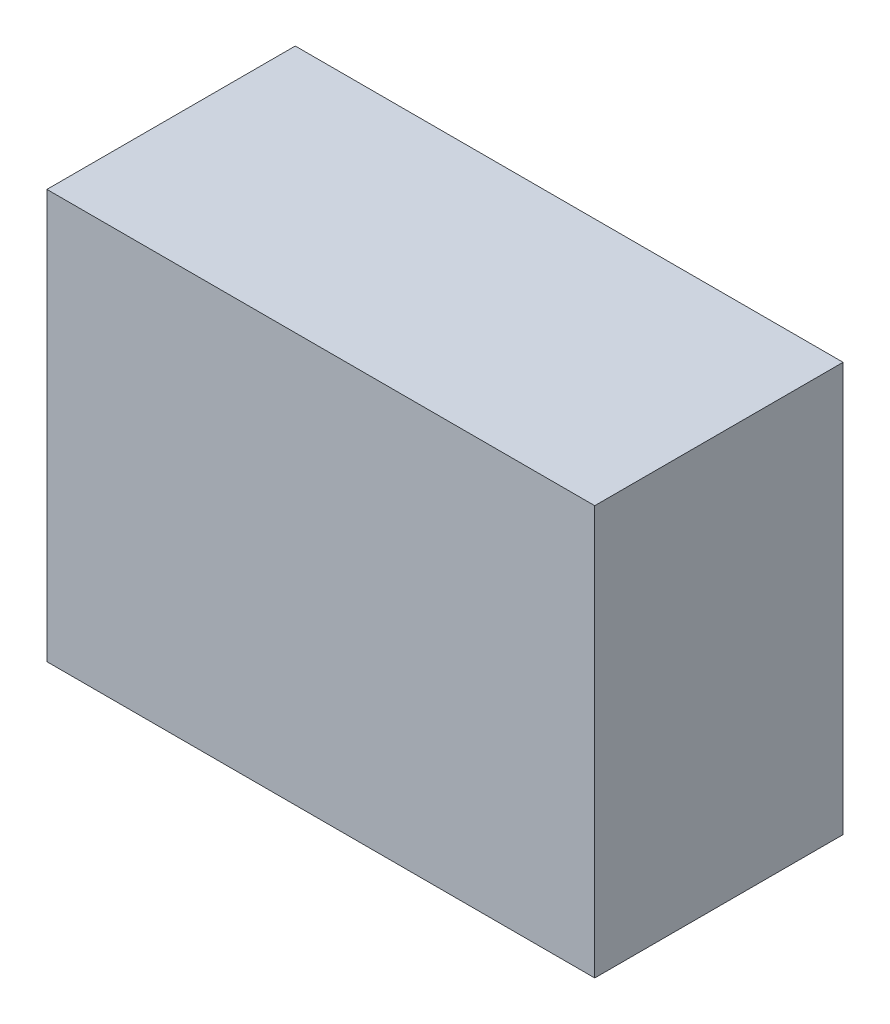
SolidWorks part; units mm, degrees
ref_plane "Front Plane" through (0, 0, 0) normal (0, 0, 1) x (1, 0, 0)
ref_plane "Top Plane" through (0, 0, 0) normal (0, 1, 0) x (1, 0, 0)
ref_plane "Right Plane" through (0, 0, 0) normal (1, 0, 0) x (0, 0, -1)
sketch "Sketch1" plane through (0, 0, 0) normal (0, 0, 1) x (1, 0, 0)
  line L1 (-47.625, -35.56) -> (47.625, -35.56)
  line L2 (-47.625, -35.56) -> (-47.625, 35.56)
  line L3 (-47.625, 35.56) -> (47.625, 35.56)
  line L4 (47.625, -35.56) -> (47.625, 35.56)
  line L5 (-47.625, -35.56) -> (47.625, 35.56) construction
  line L6 (-47.625, 35.56) -> (47.625, -35.56) construction
  point P0 (0, 0)
  dimension "D1" = 95.25
  dimension "D2" = 71.12
extrude "Boss-Extrude1" add sketch "Sketch1" along normal blind 43.18
